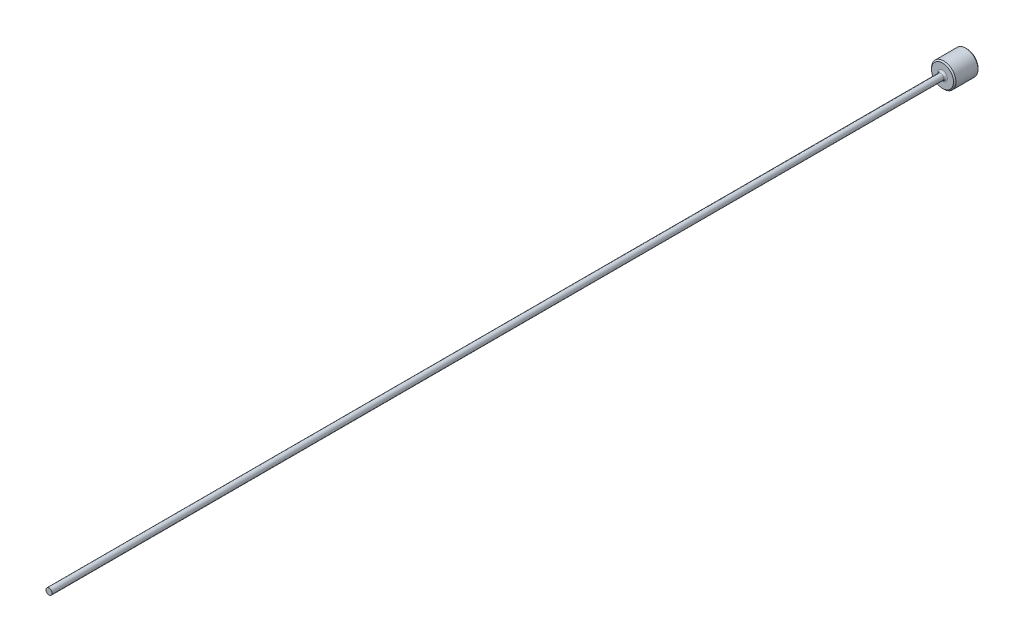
SolidWorks part; units mm, degrees
ref_plane "Front Plane" through (0, 0, 0) normal (0, 0, 1) x (1, 0, 0)
ref_plane "Top Plane" through (0, 0, 0) normal (0, 1, 0) x (1, 0, 0)
ref_plane "Right Plane" through (0, 0, 0) normal (1, 0, 0) x (0, 0, -1)
sketch "Sketch1" plane through (0, 0, 0) normal (1, 0, 0) x (0, 0, -1)
  line L0 (0, 0) -> (0, 2)
  line L1 (0, 2.2) -> (0, -2.2) construction
  line L2 (0, 2) -> (-4, 2)
  line L3 (-4, 2) -> (-4, 0.8)
  line L4 (-4.3, 0.5) -> (-150, 0.5)
  line L5 (-150, 0.5) -> (-150, 0)
  line L6 (2.2, 0) -> (-2.2, 0) construction
  line L7 (-150, 0) -> (0, 0)
  line L8 (-109.0506, 0) -> (16.9928, 0) construction
  arc A0 (-4, 0.8) -> (-4.3, 0.5) centre (-4.3, 0.8) cw
  dimension "D1" = 0.3
  dimension "D2" = 4
  dimension "D3" = 1
  dimension "D4" = 150
  dimension "D5" = 4
revolve "Revolve1" add sketch "Sketch1" angle 360 about L8
chamfer "Chamfer1" distance 0.2 angle 45 2 edges at (2, 0, 0) (2, 0, 4)
